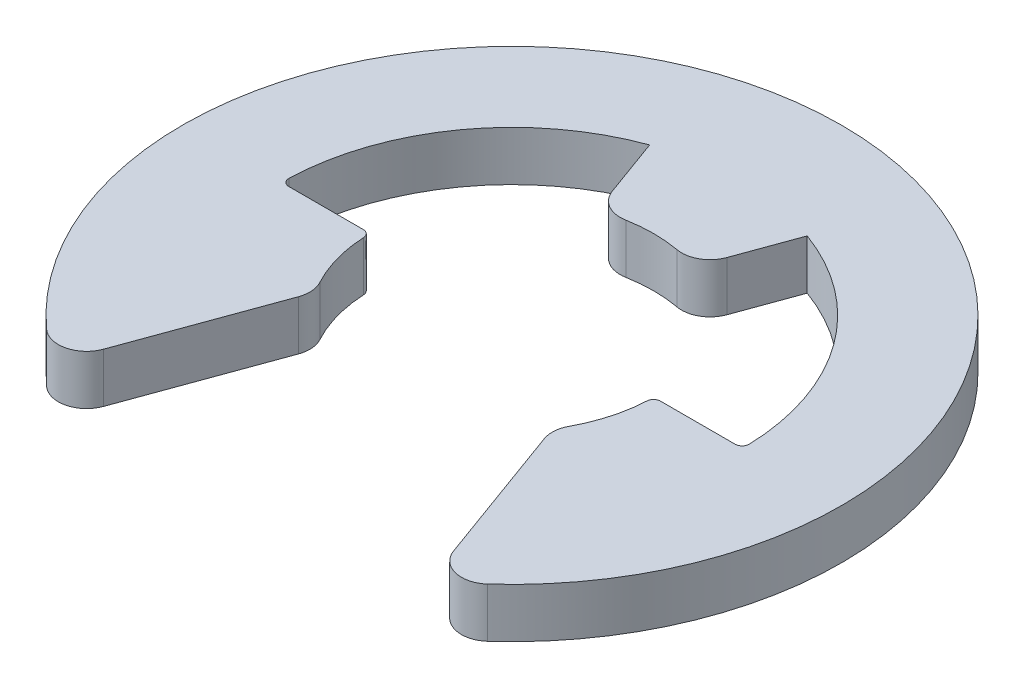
SolidWorks part; units mm, degrees
ref_plane "Front Plane" through (0, 0, 0) normal (0, 0, 1) x (1, 0, 0)
ref_plane "Top Plane" through (0, 0, 0) normal (0, 1, 0) x (1, 0, 0)
ref_plane "Right Plane" through (0, 0, 0) normal (1, 0, 0) x (0, 0, -1)
sketch "Sketch2" plane through (0, 0, 0) normal (0, 1, 0) x (1, 0, 0)
  line L0 (-2.6581, -3.8153) -> (-1.67, -1.1005)
  line L2 (1.67, -1.1005) -> (2.6581, -3.8153)
  line L4 (-2, 0) -> (-3.25, 0)
  line L5 (2, 0) -> (3.25, 0)
  line L6 (-1.1116, 3.054) -> (-0.684, 1.8794)
  line L8 (0.684, 1.8794) -> (1.1116, 3.054)
  arc A0 (2.6581, -3.8153) -> (-2.6581, -3.8153) centre (0, 0) ccw
  arc A1 (1.67, -1.1005) -> (2, 0) centre (0, 0) ccw
  arc A2 (3.25, 0) -> (1.1116, 3.054) centre (0, 0) ccw
  arc A3 (-2, 0) -> (-1.67, -1.1005) centre (0, 0) ccw
  arc A4 (0.684, 1.8794) -> (-0.684, 1.8794) centre (0, 0) ccw
  arc A5 (-1.1116, 3.054) -> (-3.25, 0) centre (0, 0) ccw
  point P15 (0, 0)
  point P16 (0, 2)
  dimension "D1" = 9.3
  dimension "D2" = 4
  dimension "D3" = 6.5
  dimension "D4" = 70
  dimension "D5" = 70
  dimension "D6" = 3.34
  dimension "D7" = 40
extrude "Boss-Extrude1" add sketch "Sketch2" along normal mid plane 0.7
fillet "Fillet1" radius 0.4 6 edges at (1.67, 0, 1.1005) (-1.67, 0, 1.1005) (0.684, 0, -1.8794) (-0.684, 0, -1.8794) (2.6581, 0, 3.8153) (-2.6581, 0, 3.8153)
fillet "Fillet2" radius 0.1 4 edges at (3.25, 0, 0) (2, 0, 0) (-3.25, 0, 0) (-2, 0, 0)
